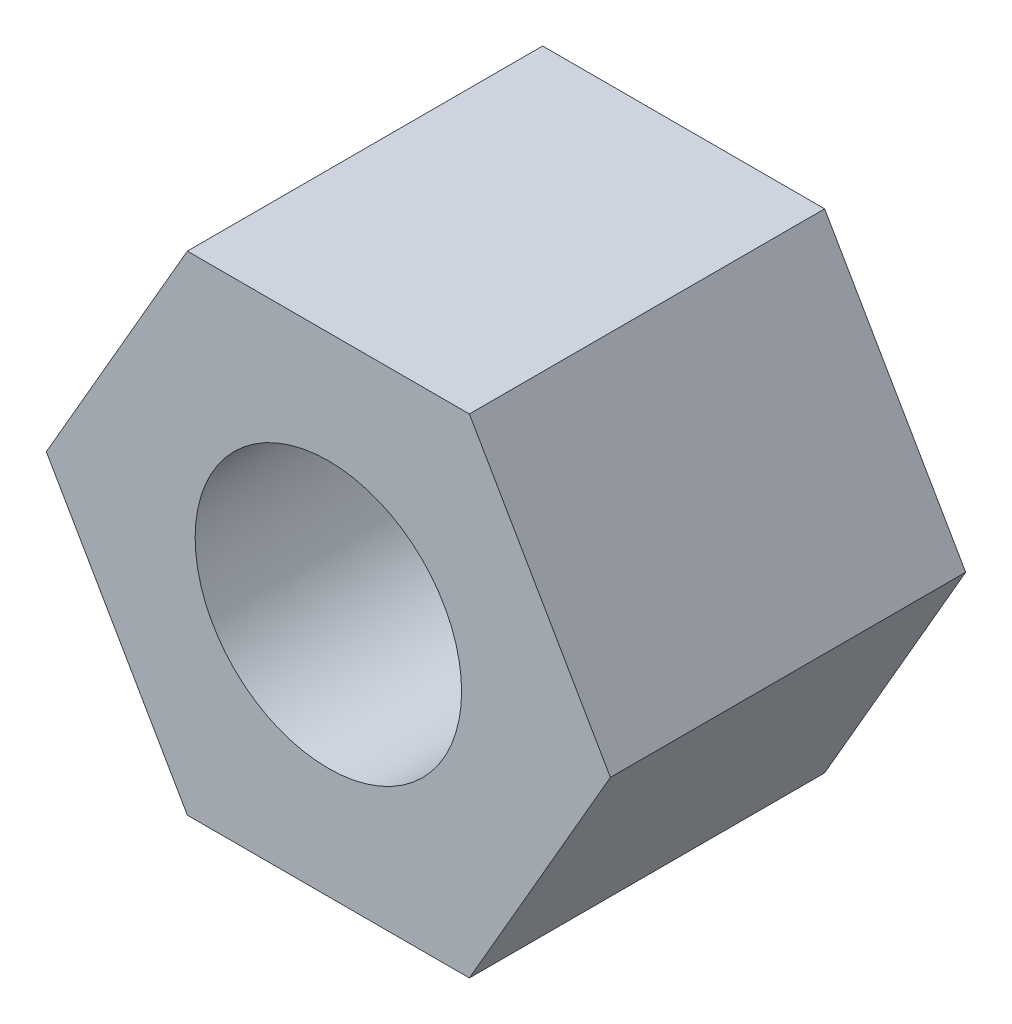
SolidWorks part; units mm, degrees
ref_plane "前视基准面" through (0, 0, 0) normal (0, 0, 1) x (1, 0, 0)
ref_plane "上视基准面" through (0, 0, 0) normal (0, 1, 0) x (1, 0, 0)
ref_plane "右视基准面" through (0, 0, 0) normal (1, 0, 0) x (0, 0, -1)
other "Configuration Table"
sketch "草图1" plane through (0, 0, 0) normal (0, 0, 1) x (1, 0, 0)
  line L0 (3.1754, 0) -> (1.5877, 2.75)
  line L1 (1.5877, 2.75) -> (-1.5877, 2.75)
  line L2 (-1.5877, 2.75) -> (-3.1754, 0)
  line L3 (-3.1754, 0) -> (-1.5877, -2.75)
  line L4 (-1.5877, -2.75) -> (1.5877, -2.75)
  line L5 (1.5877, -2.75) -> (3.1754, 0)
  circle A0 centre (0, 0) radius 1.5
  dimension "D1" = 3
  dimension "D2" = 1.5877
  dimension "D3" = 3.1754
  dimension "D4" = 1.5877
extrude "Nylock_external_envelope" add sketch "草图1" along normal blind 4
